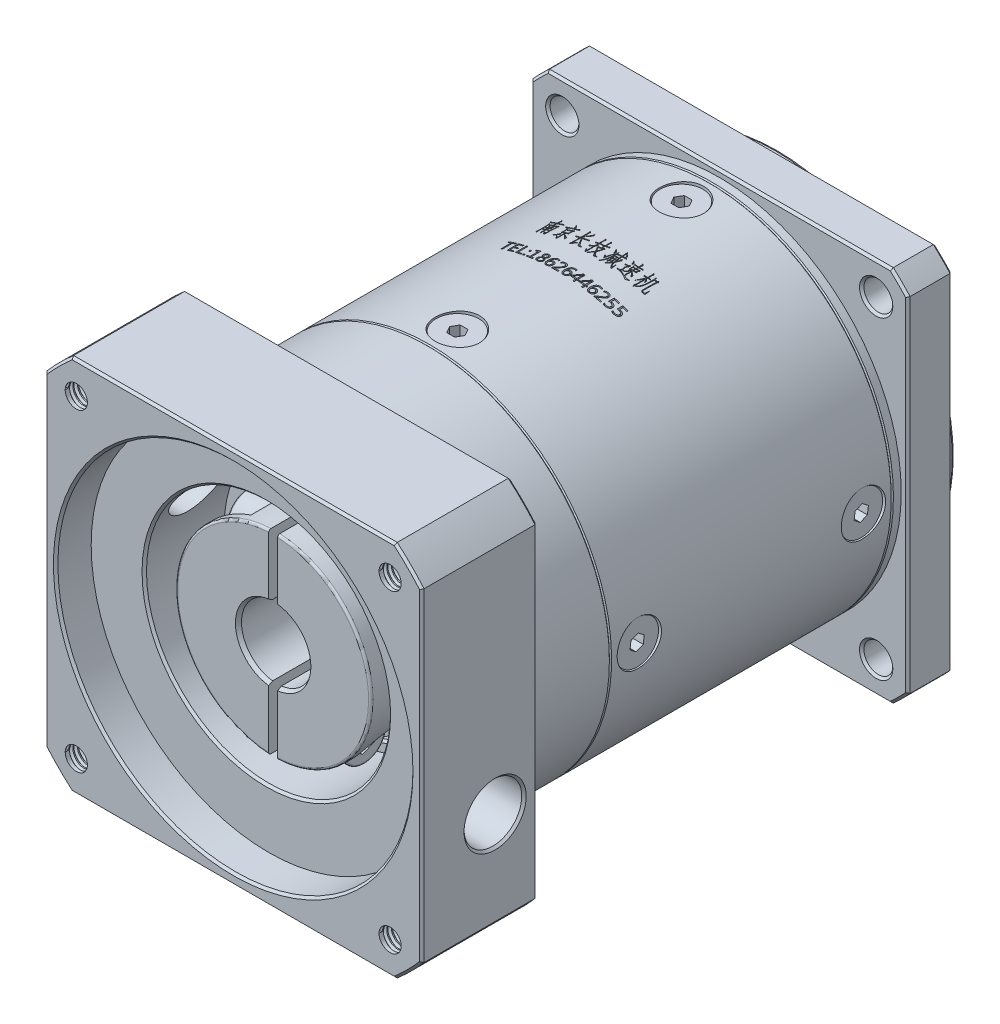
SolidWorks part; units mm, degrees
ref_plane "前视基准面" through (0, 0, 0) normal (0, 0, 1) x (1, 0, 0)
ref_plane "上视基准面" through (0, 0, 0) normal (0, 1, 0) x (1, 0, 0)
ref_plane "右视基准面" through (0, 0, 0) normal (1, 0, 0) x (0, 0, -1)
imported_body "16-80-100-M6-1-solid1"
imported_body "16-80-100-M6-1-solid2"
imported_body "16-80-100-M6-1-solid3"
imported_body "16-80-100-M6-1-solid4"
imported_body "ZF80-K15-L2-3-solid1"
imported_body "ZF80-K15-L2-3-solid2"
imported_body "ZF80-K15-L2-3-solid3"
imported_body "ZF80-K15-L2-3-solid4"
imported_body "ZF80-K15-L2-3-solid5"
imported_body "ZF80-K15-L2-3-solid6"
imported_body "ZF80-K15-L2-3-solid7"
imported_body "ZF80-K15-L2-3-solid8"
imported_body "ZF80-K15-L2-3-solid9"
sketch "草图1" plane through (0, 0, -74.2125) normal (0, 0, -1) x (-1, 0, 0)
  circle A0 centre (88.8934, 24.356) radius 11.0914
  dimension "D1" = 22.1827
extrude "凸台-拉伸1" add sketch "草图1" along normal blind 5
